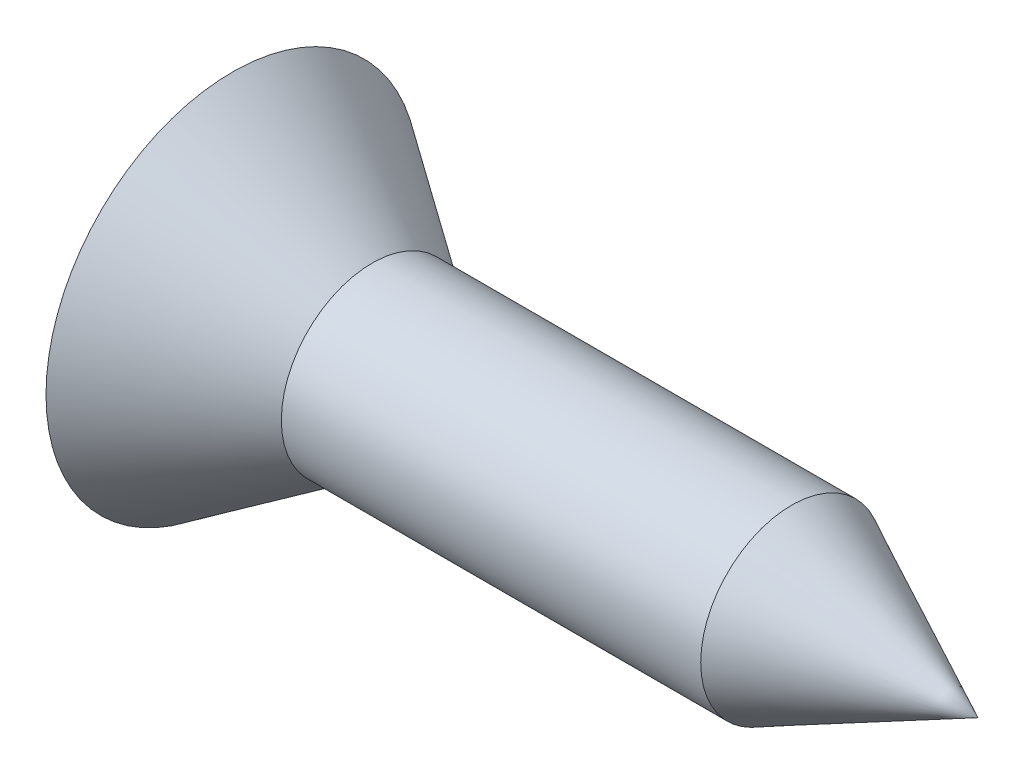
SolidWorks part; units mm, degrees
ref_plane "Plan1" through (0, 0, 0) normal (0, 0, 1) x (1, 0, 0)
ref_plane "Plan2" through (0, 0, 0) normal (0, 1, 0) x (1, 0, 0)
ref_plane "Plan3" through (0, 0, 0) normal (1, 0, 0) x (0, 0, -1)
sketch "Esquisse1" plane through (0, 0, 0) normal (0, 0, 1) x (1, 0, 0)
  line L0 (-40, 0) -> (50, 0) construction
  line L1 (0, 0) -> (0, 4)
  line L2 (0, 4) -> (3, 1.95)
  line L3 (3, 1.95) -> (12, 1.95)
  line L4 (12, 1.95) -> (16, 0)
  line L5 (0, 0) -> (16, 0)
  dimension "D1" = 16
  dimension "D2" = 9
  dimension "D3" = 4
  dimension "D4" = 3
  dimension "D5" = 3.9
revolve "Base-Révolution" add sketch "Esquisse1" angle 360 about L0
